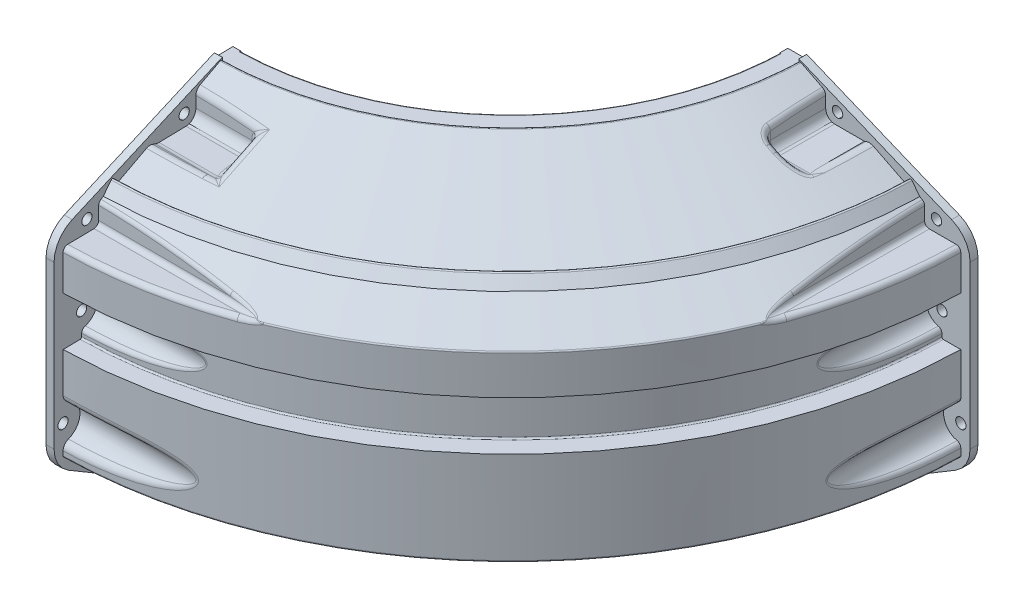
SolidWorks part; units mm, degrees
ref_plane "Plan de face" through (0, 0, 0) normal (0, 0, 1) x (1, 0, 0)
ref_plane "Plan de dessus" through (0, 0, 0) normal (0, 1, 0) x (1, 0, 0)
ref_plane "Plan de droite" through (0, 0, 0) normal (1, 0, 0) x (0, 0, -1)
sketch "Esquisse1" plane through (0, 0, 0) normal (0, 0, 1) x (1, 0, 0)
  line L0 (0, 12) -> (0, 0)
  line L1 (0, 0) -> (12, 0)
  line L2 (0, 12) -> (-9, 12)
  line L3 (-9, 12) -> (-9, 222)
  line L4 (-9, 222) -> (3, 222)
  line L5 (3, 222) -> (3, 224)
  line L6 (3, 224) -> (73, 189)
  line L7 (73, 189) -> (73, 196)
  line L8 (73, 196) -> (79.8045, 187.3571)
  line L9 (79.8045, 187.3571) -> (105.7852, 172.3571)
  line L10 (105.7852, 172.3571) -> (105.7852, 147.3571)
  line L11 (12, 0) -> (105.7852, 57.3571)
  line L12 (105.7852, 116.3571) -> (105.7852, 57.3571)
  line L13 (105.7852, 147.3571) -> (93.7852, 147.3571)
  line L14 (-184, 259.3744) -> (-184, -51.1512) construction
  line L15 (105.7852, 116.3571) -> (93.7852, 116.3571)
  line L16 (93.7852, 147.3571) -> (93.7852, 116.3571)
  dimension "D1" = 12
  dimension "D2" = 12
  dimension "D3" = 9
  dimension "D4" = 210
  dimension "D5" = 12
  dimension "D6" = 2
  dimension "D7" = 35
  dimension "D8" = 70
  dimension "D9" = 7
  dimension "D10" = 11
  dimension "D11" = 7
  dimension "D12" = 30
  dimension "D13" = 60
  dimension "D14" = 115
  dimension "D15" = 31
  dimension "D16" = 25
  dimension "D17" = 12
  dimension "D18" = 175
revolve "Révolution1" add sketch "Esquisse1" angle 90 about L14
fillet "Congé1" radius 1 7 edges at (-2.2736, 196, 181.7264) (12.4238, 147.3571, 196.4238) (12.4238, 116.3571, 196.4238) (20.9091, 57.3571, 204.9091) (20.9091, 172.3571, 204.9091) (-60.2563, 222, 123.7437) (-51.771, 224, 132.229)
sketch "Esquisse3" plane through (-184, 0, 0) normal (-1, 0, 0) x (0, 0, 1)
  line L0 (204, 200.5) -> (204, 215.5)
  line L1 (257, 189) -> (188.4472, 223.2764) construction
  line L2 (175, 221) -> (175, 12) construction
  line L3 (204, 215.5) -> (221.5354, 225.7222)
  line L4 (209.0585, 198.6588) -> (229.0585, 198.6588)
  line L5 (229.0585, 198.6588) -> (234, 200.5)
  line L6 (209.0585, 198.6588) -> (204, 200.5)
  line L7 (221.5354, 225.7222) -> (234, 200.5)
  dimension "D1" = 20
  dimension "D2" = 30
  dimension "D3" = 29
  dimension "D4" = 110
  dimension "D5" = 47
extrude "Enlèv. mat.-Extru.1" cut sketch "Esquisse3" against normal blind 42
fillet "Congé2" radius 7 3 edges at (-163, 198.6588, 229.0585) (-163, 198.6588, 209.0585) (-163, 200.5, 204)
fillet "Congé3" radius 5 3 edges at (-162.9876, 200.2985, 233.4593)
fillet "Congé4" radius 3 9 edges at (-138.3145, 199.0992, 231.6453) (-140.9259, 198.698, 228.536) (-142, 198.6588, 215.9324) (-140.1665, 211.6772, 203.7223) (-141.6629, 209.2454, 204) (-142, 206.3196, 204) (-142, 198.735, 209.2631) (-142, 201.542, 205.1601)
sketch "Esquisse4" plane through (-184, 0, 0) normal (-1, 0, 0) x (0, 0, 1)
  line L0 (266.7686, 185.6458) -> (266.7686, 172.6458)
  line L1 (289.2852, 172.6458) -> (263.8045, 187.3571) construction
  line L2 (266.7686, 172.6458) -> (289.2852, 172.6458)
  line L3 (289.7852, 147.3571) -> (289.7852, 171.7798) construction
  line L4 (266.7686, 185.6458) -> (289.2852, 172.6458)
  dimension "D1" = 90
  dimension "D2" = 13
extrude "Enlèv. mat.-Extru.2" cut sketch "Esquisse4" against normal blind 120
fillet "Congé5" radius 3 1 edges at (-128.0525, 172.6458, 266.7686)
fillet "Congé6" radius 3 3 edges at (-130.8686, 172.6458, 284.3642) (-77.705, 173.1653, 268.0813)
sketch "Esquisse5" plane through (-184, 0, 0) normal (-1, 0, 0) x (0, 0, 1)
  line L0 (277.7852, 117.3571) -> (277.7852, 146.3571) construction
  circle A0 centre (277.7852, 131.8571) radius 10
  dimension "D1" = 20
extrude "Enlèv. mat.-Extru.3" cut sketch "Esquisse5" against normal blind 120
fillet "Congé7" radius 3 1 edges at (-110.2497, 132.6436, 267.8162)
sketch "Esquisse6" plane through (-184, 0, 0) normal (-1, 0, 0) x (0, 0, 1)
  line L0 (289.7852, 57.9178) -> (289.7852, 116.3571) construction
  circle A0 centre (289.7852, 75.9178) radius 11
  dimension "D2" = 22
  dimension "D1" = 18
extrude "Enlèv. mat.-Extru.4" cut sketch "Esquisse6" against normal blind 120
fillet "Congé8" radius 5 1 edges at (-105.2362, 77.3269, 278.8759)
sketch "Esquisse7" plane through (-184, 0, 0) normal (-1, 0, 0) x (0, 0, 1)
  line L0 (200, 2.4463) -> (200, 22.4463)
  line L1 (196, 0) -> (289.307, 57.0646) construction
  line L2 (200, 22.4463) -> (232.7022, 22.4463)
  line L3 (184, 12) -> (184, 0) construction
  line L5 (200, 2.4463) -> (232.7022, 22.4463)
  dimension "D1" = 16
  dimension "20" = 20
extrude "Enlèv. mat.-Extru.6" cut sketch "Esquisse7" against normal blind 77
fillet "Congé10" radius 4 5 edges at (-144.9461, 22.4463, 229.4016) (-107, 22.4463, 209.7968) (-145.5, 22.4463, 200)
sketch "Esquisse9" plane through (0, 0, 0) normal (0, 0, -1) x (-1, 0, 0)
  line L1 (-73, 189) -> (-4.4472, 223.2764) construction
  line L2 (9, 221) -> (9, 12) construction
  line L3 (-20.0037, 201.8821) -> (-20.0037, 215.4982)
  line L4 (-20.0037, 215.4982) -> (-48.0403, 201.4798)
  line L5 (-44.6152, 200.2037) -> (-24.6152, 200.2037)
  line L6 (-44.6152, 200.2037) -> (-48.0403, 201.4798)
  line L7 (-24.6152, 200.2037) -> (-20.0037, 201.8821)
  dimension "D1" = 29.0037
  dimension "D2" = 20
  dimension "D3" = 110
  dimension "D4" = 47
  dimension "D5" = 90
extrude "Enlèv. mat.-Extru.8" cut sketch "Esquisse9" against normal blind 44
fillet "Congé11" radius 6 3 edges at (47.4417, 201.2568, 22.0145) (24.6152, 200.2037, 22) (20.0037, 201.8821, 22)
fillet "Congé12" radius 4 7 edges at (48.6858, 200.2037, 29.8506) (20.0037, 209.618, 44) (24.718, 200.2802, 44) (21.0388, 202.7143, 44) (36.0513, 200.2037, 44)
sketch "Esquisse10" plane through (0, 0, 0) normal (0, 0, -1) x (-1, 0, 0)
  line L0 (-105.2852, 172.6458) -> (-82.7686, 172.6458)
  line L1 (-82.7686, 172.6458) -> (-82.7686, 185.6458)
  line L2 (-105.2852, 172.6458) -> (-79.8045, 187.3571) construction
  line L3 (-82.7686, 185.6458) -> (-105.2852, 172.6458)
  dimension "D1" = 13
extrude "Enlèv. mat.-Extru.9" cut sketch "Esquisse10" against normal blind 138
fillet "Congé13" radius 3 1 edges at (82.7686, 172.6458, 55.9475)
fillet "Congé15" radius 3 3 edges at (84.1914, 173.0939, 106.3529)
sketch "Esquisse11" plane through (0, 0, 0) normal (0, 0, -1) x (-1, 0, 0)
  line L0 (-93.7852, 117.3571) -> (-93.7852, 146.3571) construction
  circle A0 centre (-93.7852, 131.8571) radius 10
  dimension "D1" = 20
extrude "Enlèv. mat.-Extru.10" cut sketch "Esquisse11" against normal blind 138
fillet "Congé16" radius 3 1 edges at (83.8162, 131.0706, 73.7503)
sketch "Esquisse12" plane through (0, 0, 0) normal (0, 0, -1) x (-1, 0, 0)
  line L0 (-105.7852, 57.9178) -> (-105.7852, 116.3571) construction
  circle A0 centre (-105.7852, 75.9178) radius 11
  dimension "D1" = 22
  dimension "D2" = 18
extrude "Enlèv. mat.-Extru.11" cut sketch "Esquisse12" against normal blind 138
fillet "Congé17" radius 3 1 edges at (94.8759, 74.5086, 78.7638)
sketch "Esquisse13" plane through (0, 0, 0) normal (0, 0, -1) x (-1, 0, 0)
  line L0 (-16, 2.4463) -> (-16, 22.4463)
  line L1 (-12, 0) -> (-105.307, 57.0646) construction
  line L2 (0, 12) -> (0, 0) construction
  line L3 (-16, 22.4463) -> (-48.7022, 22.4463)
  line L4 (-48.7022, 22.4463) -> (-16, 2.4463)
  dimension "D1" = 16
  dimension "D2" = 20
extrude "Enlèv. mat.-Extru.12" cut sketch "Esquisse13" against normal blind 77
fillet "Congé18" radius 4 5 edges at (45.4016, 22.4463, 39.0539) (16, 16.8223, 77) (16, 22.4463, 38.5)
fillet "Congé19" radius 4 4 edges at (17.1716, 21.2747, 75.8284) (34.6091, 22.795, 81.2199) (32.2245, 22.4463, 78.4866) (22.9762, 22.4463, 77)
sketch "Esquisse14" plane through (0, 0, 0) normal (0, 0, -1) x (-1, 0, 0)
  line L0 (9, 221) -> (9, 12) construction
  line L1 (9, 41) -> (-51, 41)
  line L2 (9, 41) -> (9, 181)
  line L3 (9, 181) -> (-51, 181)
  line L4 (-51, 41) -> (-51, 181)
  line L5 (-3, 222) -> (8, 222) construction
  dimension "D1" = 60
  dimension "D2" = 140
  dimension "D3" = 41
extrude "Enlèv. mat.-Extru.13" cut sketch "Esquisse14" against normal blind 3
sketch "Esquisse15" plane through (-9, 0, 0) normal (1, 0, 0) x (0, 0, -1)
  line L1 (0, 181) -> (-3, 181)
  line L2 (0, 181) -> (0, 41)
  line L3 (0, 41) -> (-3, 41)
  line L4 (-3, 181) -> (-3, 41)
  dimension "D1" = 3
  dimension "D2" = 140
extrude "Enlèv. mat.-Extru.14" cut sketch "Esquisse15" against normal blind 38
sketch "Esquisse16" plane through (-184, 0, 0) normal (-1, 0, 0) x (0, 0, 1)
  line L0 (175, 221) -> (175, 12) construction
  line L1 (175, 181) -> (235, 181)
  line L2 (175, 181) -> (175, 41)
  line L3 (175, 41) -> (235, 41)
  line L4 (235, 181) -> (235, 41)
  line L5 (187, 222) -> (176, 222) construction
  dimension "D1" = 140
  dimension "D2" = 41
  dimension "D3" = 60
extrude "Enlèv. mat.-Extru.15" cut sketch "Esquisse16" against normal blind 3
sketch "Esquisse17" plane through (0, 0, 175) normal (0, 0, 1) x (1, 0, 0)
  line L1 (-184, 181) -> (-181, 181)
  line L2 (-184, 181) -> (-184, 41)
  line L3 (-184, 41) -> (-181, 41)
  line L4 (-181, 181) -> (-181, 41)
extrude "Enlèv. mat.-Extru.16" cut sketch "Esquisse17" against normal blind 3
sketch "Esquisse19" plane through (0, 0, 0) normal (0, 0, -1) x (-1, 0, 0)
  line L0 (0, 0) -> (0, 12)
  line L1 (0, 12) -> (9, 12)
  line L2 (9, 12) -> (9, 222)
  line L3 (9, 222) -> (-3, 222)
  line L4 (-3, 222) -> (-3, 224.6812)
  line L5 (-3, 224.6812) -> (-111.6436, 179.9865)
  line L6 (-111.6436, 179.9865) -> (-111.6436, 53.9233)
  line L7 (-111.6436, 53.9233) -> (-21.7492, 0)
  line L8 (-21.7492, 0) -> (0, 0)
extrude "Boss.-Extru.1" add sketch "Esquisse19" against normal blind 5
pattern_circular "Répétition circulaire1" count 2 over 360 about axis through (-184, 259.3744, 0) along (0, 1, 0) of "Boss.-Extru.1"
scale "Echelle2" scale about centroid uniform scaling yes scale factor 2.5
scale "Echelle3" scale about centroid uniform scaling yes scale factor 2.114
fillet "Congé20" radius 100 4 edges at (-795.1495, -196.505, 934.8248) (-795.1495, 469.7386, 934.8248) (753.2686, -196.505, -614.4319) (753.2686, 469.7386, -614.4319)
sketch "Esquisse20" plane through (-798.0093, 0, 13.9293) normal (0.9998, 0, -0.0175) x (-0.0175, 0, -0.9998)
  line L0 (-582.2077, -362.8611) -> (-436.6328, -362.8611) construction
  line L1 (-415.4895, -384.0011) -> (-415.4895, -456.6093) construction
  line L3 (-784.2727, 430.9432) -> (-873.9886, 430.9432) construction
  line L4 (-768.4153, 490.369) -> (-768.4153, 446.7982) construction
  line L5 (-436.6328, 641.0119) -> (-436.6328, 604.0568) construction
  line L6 (-469.8953, 568.4221) -> (-562.4181, 568.4221) construction
  circle A0 centre (-476.6328, 618.4221) radius 17.5
  circle A1 centre (-808.4153, 470.9432) radius 17.5
  circle A2 centre (-826.6472, 215.3751) radius 17.5
  circle A3 centre (-890.0769, -80.2646) radius 17.5
  circle A4 centre (-465.4895, -412.8611) radius 17.5
  ellipse E0 centre (-890.0769, -80.2646) end of major axis (-831.933, -80.2646) minor radius 58.135 (-871.7475, -135.4354) -> (-871.7475, -25.0938) ccw construction
  ellipse E1 centre (-826.6472, 215.3751) end of major axis (-773.7891, 215.3751) minor radius 52.85 (-814.2782, 163.9925) -> (-814.2782, 266.7577) ccw construction
  dimension "D3" = 35
  dimension "D4" = 40
  dimension "D1" = 50
  dimension "D2" = 50
  dimension "D5" = 40
  dimension "D6" = 40
  dimension "D7" = 50
extrude "Enlèv. mat.-Extru.17" cut sketch "Esquisse20" against normal through all
sketch "Esquisse21" plane through (0, 0, -601.2194) normal (0, 0, 1) x (1, 0, 0)
  line L0 (247.792, -384.0011) -> (247.792, -456.5037) construction
  line L1 (414.3858, -362.8611) -> (268.932, -362.8611) construction
  line L2 (298.9146, 576.5865) -> (399.0233, 576.5865) construction
  line L3 (268.9514, 644.1875) -> (268.9514, 607.6607) construction
  line L4 (616.519, 430.9432) -> (706.2216, 430.9432) construction
  line L5 (600.664, 490.3498) -> (600.664, 446.7982) construction
  circle A0 centre (308.9514, 616.5865) radius 17.5
  circle A1 centre (640.664, 470.9432) radius 17.5
  circle A2 centre (658.887, 215.3751) radius 17.5
  circle A3 centre (722.307, -80.2646) radius 17.5
  circle A4 centre (297.792, -412.8611) radius 17.5
  arc A5 (646.5059, 266.7544) -> (646.5059, 163.9958) centre (658.887, 215.3751) ccw construction
  arc A6 (709.6685, -23.52) -> (709.6685, -137.0091) centre (722.307, -80.2646) ccw construction
  dimension "D1" = 35
  dimension "D2" = 50
  dimension "D3" = 50
  dimension "D4" = 40
  dimension "D5" = 40
  dimension "D6" = 40
  dimension "D7" = 40
extrude "Enlèv. mat.-Extru.18" cut sketch "Esquisse21" against normal through all
